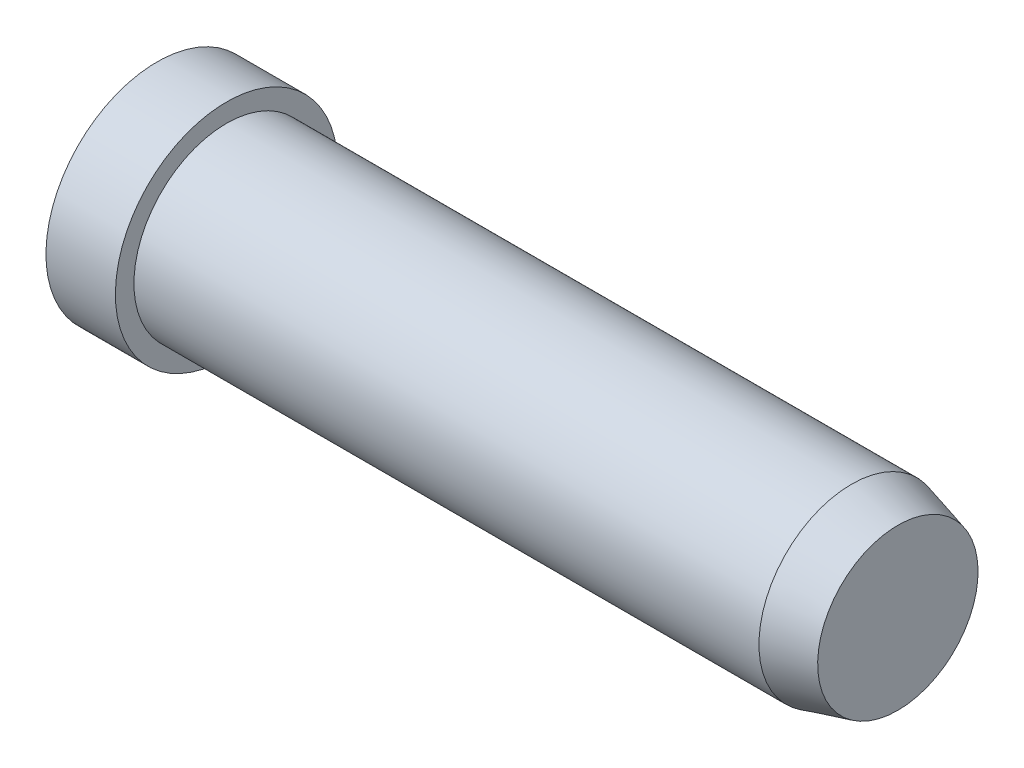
SolidWorks part; units mm, degrees
ref_plane "Front Plane" through (0, 0, 0) normal (0, 0, 1) x (1, 0, 0)
ref_plane "Top Plane" through (0, 0, 0) normal (0, 1, 0) x (1, 0, 0)
ref_plane "Right Plane" through (0, 0, 0) normal (1, 0, 0) x (0, 0, -1)
sketch "Sketch1" plane through (0, 0, 0) normal (0, 0, 1) x (1, 0, 0)
  line L0 (160, 0) -> (0, 0) construction
  line L1 (0, 0) -> (0, 24)
  line L2 (0, 24) -> (15, 24)
  line L3 (15, 24) -> (15, 20)
  line L4 (150, 20) -> (160, 17.3205)
  line L7 (15, 20) -> (150, 20)
  line L8 (160, 17.3205) -> (160, 0)
  line L9 (160, 0) -> (0, 0)
  line L10 (0, 0) -> (-20.5437, 0) construction
  line L11 (160, 0) -> (166.5423, 0) construction
  dimension "D1" = 15
  dimension "HeadDia" = 48
  dimension "HeadThickness" = 15
  dimension "OverAllLength" = 160
  dimension "PinDia" = 40
  dimension "N" = 10
revolve "Revolve1" add sketch "Sketch1" angle 360 about L0
